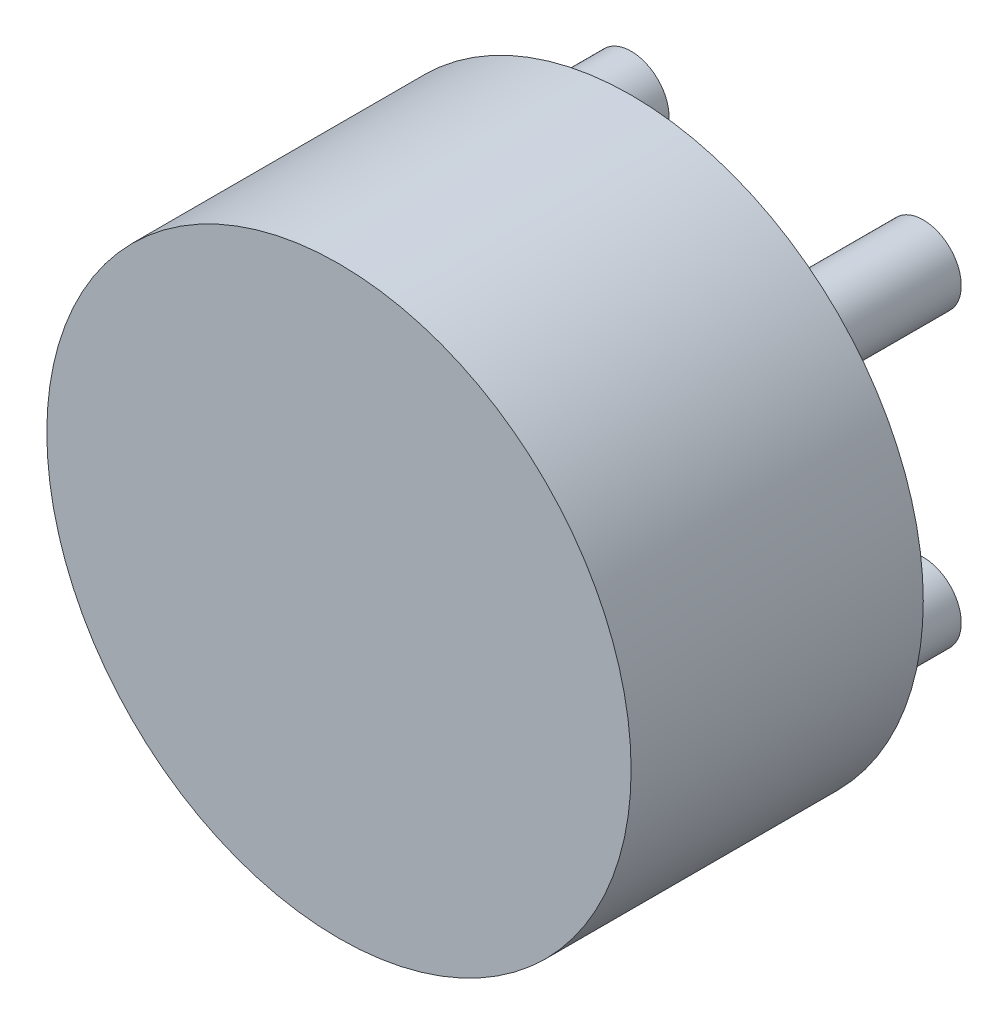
SolidWorks part; units mm, degrees
ref_plane "Спереди" through (0, 0, 0) normal (0, 0, 1) x (1, 0, 0)
ref_plane "Сверху" through (0, 0, 0) normal (0, 1, 0) x (1, 0, 0)
ref_plane "Справа" through (0, 0, 0) normal (1, 0, 0) x (0, 0, -1)
sketch "Эскиз1" plane through (0, 0, 0) normal (0, 0, 1) x (1, 0, 0)
  circle A0 centre (0, 0) radius 5.08
extrude "Бобышка-Вытянуть1" add sketch "Эскиз1" along normal blind 5.08
sketch "Эскиз2" plane through (0, 0, 0) normal (0, 0, -1) x (-1, 0, 0)
  circle A0 centre (2.54, 2.54) radius 0.6604
  circle A1 centre (-2.54, 2.54) radius 0.6604
  circle A2 centre (-2.54, -2.54) radius 0.6604
  circle A3 centre (2.54, -2.54) radius 0.6604
extrude "Бобышка-Вытянуть2" add sketch "Эскиз2" along normal blind 2.54 separate body
